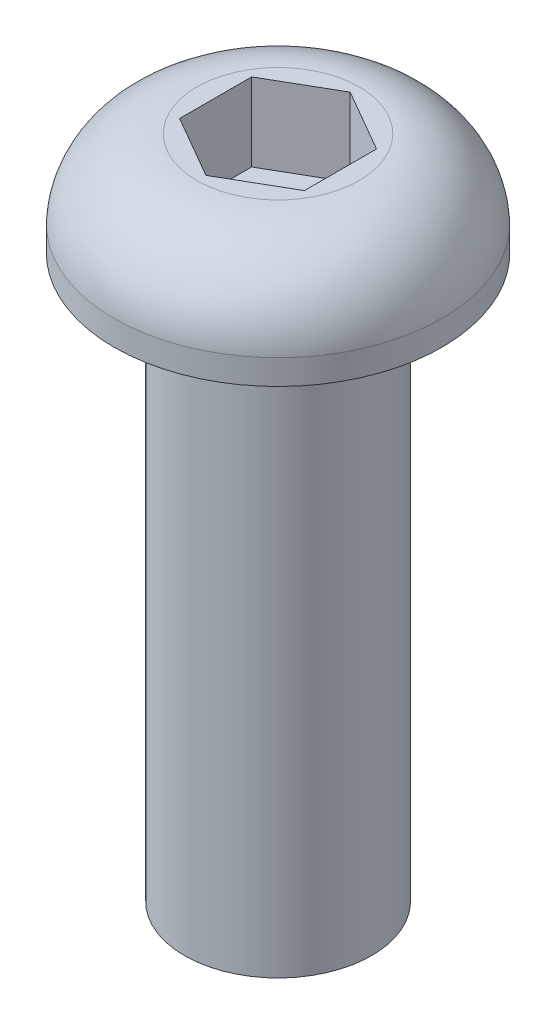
SolidWorks part; units mm, degrees
ref_plane "Plane1" through (0, 0, 0) normal (0, 0, 1) x (1, 0, 0)
ref_plane "Plane2" through (0, 0, 0) normal (0, 1, 0) x (1, 0, 0)
ref_plane "Plane3" through (0, 0, 0) normal (1, 0, 0) x (0, 0, -1)
sketch "Sketch1" plane through (0, 0, 0) normal (0, 0, 1) x (1, 0, 0)
  line L0 (0, 0) -> (2.6, 0)
  line L1 (3, -3.3) -> (5.25, -3.3)
  line L2 (5.25, -2.5) -> (5.25, -3.3)
  line L4 (3, -3.3) -> (3, -21.3)
  line L5 (0, 25.4) -> (0, -50.8) construction
  line L6 (3, -21.3) -> (0, -21.3)
  line L7 (0, 0) -> (0, -21.3)
  arc A0 (2.6, 0) -> (5.25, -2.5) centre (2.6, -2.6545) cw
  dimension "FlatFace" = 0.8
  dimension "NominalDia" = 6
  dimension "CapDia" = 10.5
  dimension "FlatDia" = 5.2
revolve "Screw" add sketch "Sketch1" angle 360 about L5
sketch "Sketch2" plane through (0, 0, 0) normal (0, 1, 0) x (-1, 0, 0)
  line L0 (0, -5.08) -> (0, 5.08) construction
  line L1 (5.3975, 0) -> (-9.3975, 0) construction
  line L2 (-2, -1.1547) -> (-2, 1.1547)
  line L3 (0, 2.3094) -> (-2, 1.1547)
  line L4 (0, 2.3094) -> (2, 1.1547)
  line L5 (2, -1.1547) -> (2, 1.1547)
  line L6 (0, -2.3094) -> (-2, -1.1547)
  line L7 (0, -2.3094) -> (2, -1.1547)
  point P8 (-2, 0)
  dimension "D1" = 120
extrude "HexCut" cut sketch "Sketch2" against normal blind 2.5
equation "\"FlatDia@Sketch1\"=\"HexWidth@Sketch2\"*1.3"
equation "\"Depth@HexCut\"=\"CapHeight@Sketch1\"-\"FlatFace@Sketch1\""
